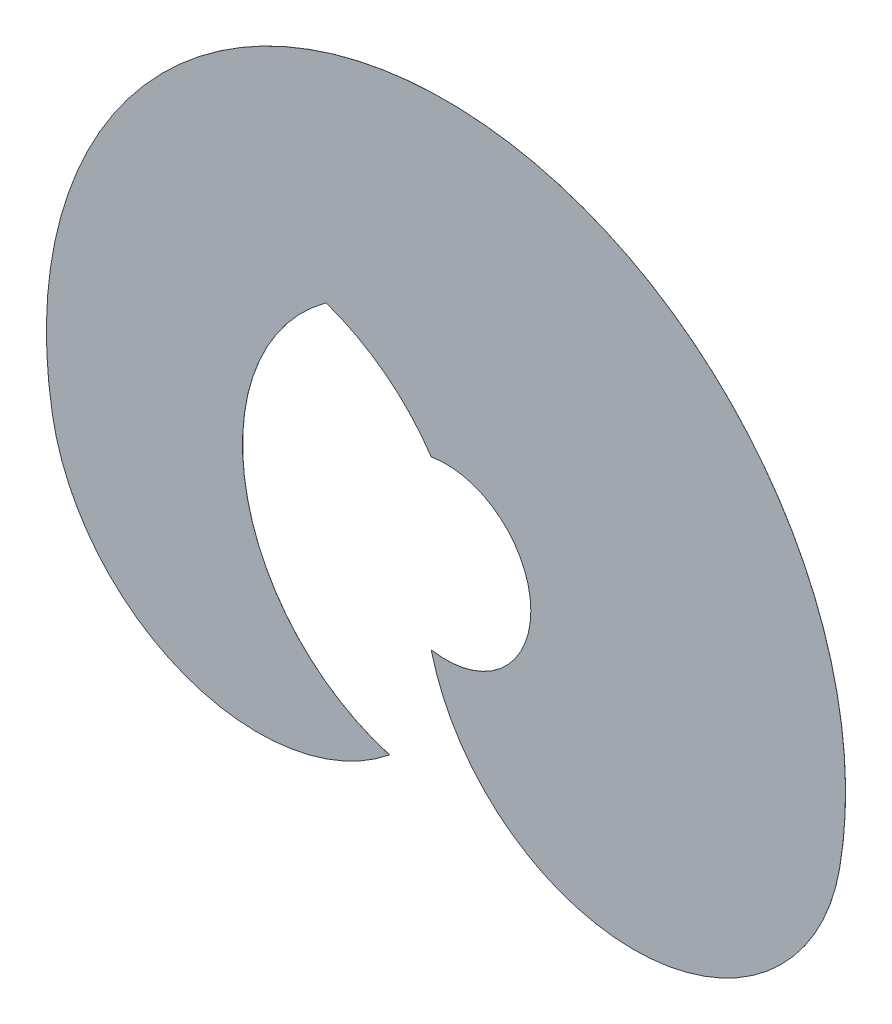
SolidWorks part; units mm, degrees
ref_plane "前视基准面" through (0, 0, 0) normal (0, 0, 1) x (1, 0, 0)
ref_plane "上视基准面" through (0, 0, 0) normal (0, 1, 0) x (1, 0, 0)
ref_plane "右视基准面" through (0, 0, 0) normal (1, 0, 0) x (0, 0, -1)
sketch "草图1" plane through (0, 0, 0) normal (0, 0, 1) x (1, 0, 0)
  line L0 (0, 0) -> (0, 1951.8831) construction
  line L1 (250, 607) -> (250, 1777) construction
  line L2 (250, 1777) -> (250, 3057.7127) construction
  line L3 (250, 3057.7127) -> (447.5463, 1808.2326) construction
  line L4 (447.5463, 1808.2326) -> (250, 1777) construction
  line L5 (250, 607) -> (1402.2251, 403.8316) construction
  line L6 (250, 607) -> (-902.2251, 403.8316) construction
  line L7 (250, 1777) -> (770.5913, 606.8676) construction
  line L8 (250, 1777) -> (443.1852, 1828.7638) construction
  line L9 (443.1852, 1828.7638) -> (770.5913, 606.8676) construction
  line L10 (250, 1777) -> (-870.3071, 1156.406) construction
  line L11 (250, 1777) -> (318.404, 1589.0615) construction
  line L12 (318.404, 1589.0615) -> (-870.3071, 1156.406) construction
  line L13 (250, 1777) -> (-59.9278, 1777) construction
  arc A0 (2663.4809, 181.4382) -> (-2163.4809, 181.4382) centre (250, 607) ccw
  arc A1 (159.4699, 94.3407) -> (159.7306, 1119.7053) centre (250, 607) ccw
  arc A3 (-2163.4809, 181.4382) -> (-96.52, -591.6905) centre (-902.2251, 403.8316) ccw
  arc A5 (-485.5986, 1614.8838) -> (-96.52, -591.6905) centre (250, 607) ccw
  arc A7 (159.4699, 94.3407) -> (2663.4809, 181.4382) centre (1402.2251, 403.8316) ccw
  arc A8 (159.7306, 1119.7053) -> (-485.5986, 1614.8838) centre (-902.2251, 403.8316) ccw
  dimension "D2" = 250
  dimension "D3" = 1170
  dimension "D4" = 200
  dimension "D5" = 1265
  dimension "D6" = 100
  dimension "D7" = 1170
  dimension "D8" = 100
  dimension "D9" = 1170
  dimension "D10" = 165
  dimension "D11" = 200
  dimension "D12" = 1265
  dimension "D13" = 1265
  dimension "D14" = 200
  dimension "D15" = 165
  dimension "D16" = 607
  dimension "D17" = 110
extrude "凸台-拉伸1" add sketch "草图1" along normal blind 0.5
